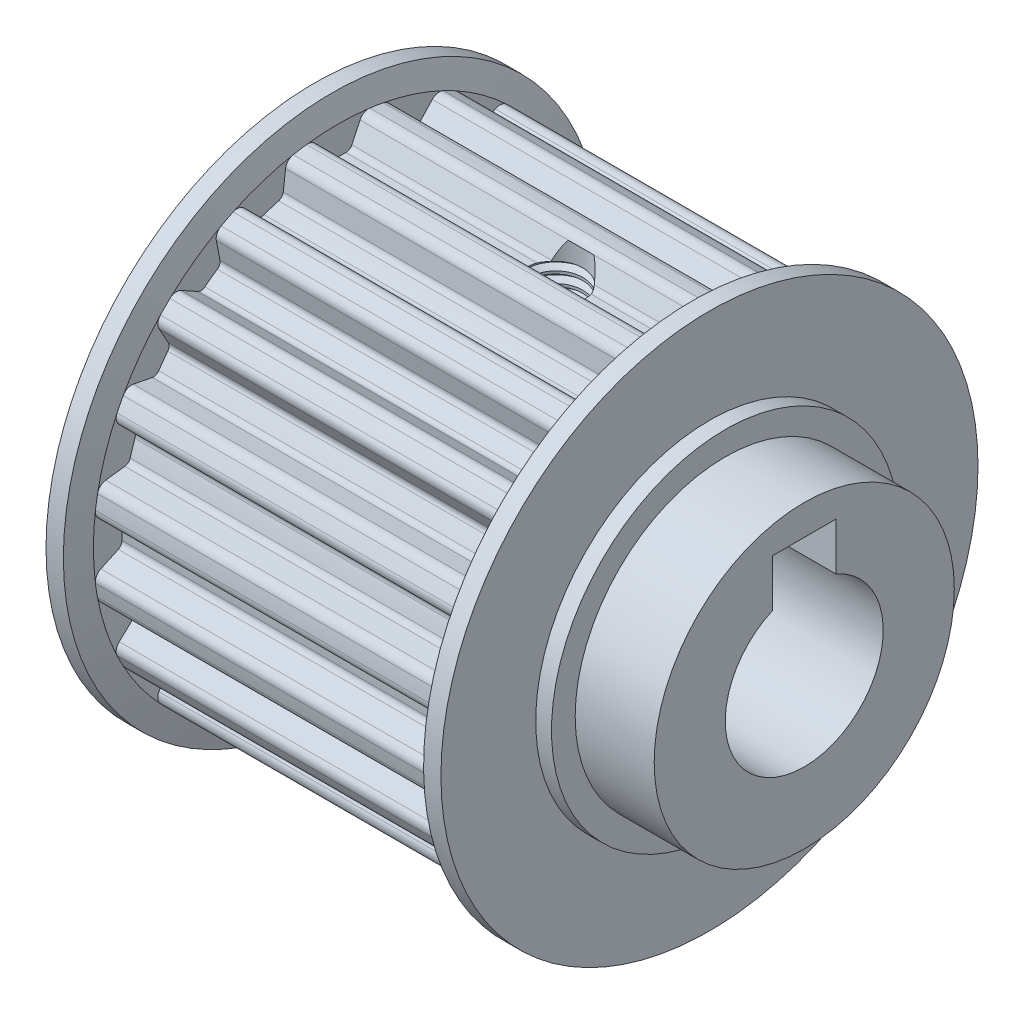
SolidWorks part; units mm, degrees
ref_plane "Front" through (0, 0, 0) normal (0, 0, 1) x (1, 0, 0)
ref_plane "Top" through (0, 0, 0) normal (0, 1, 0) x (1, 0, 0)
ref_plane "Right" through (0, 0, 0) normal (1, 0, 0) x (0, 0, -1)
imported_body "Hammashihnapyörä 20T5_20D10K4"
sketch "Sketch1" plane through (39, 0, 0) normal (1, 0, 0) x (0, 0, -1)
  line L0 (-1.5, 3.7081) -> (-1.5, 5.4)
  line L1 (-1.5, 5.4) -> (1.5, 5.4)
  line L2 (1.5, 5.4) -> (1.5, 3.7081)
  line L3 (3.994, 0.2194) -> (9.4857, 0.5211)
  line L4 (-3.0915, -2.5382) -> (2.3763, -9.198)
  circle A0 centre (0, 0) radius 9.5
  arc A1 (-1.5, 3.7081) -> (1.5, 3.7081) centre (0, 0) ccw
extrude "Boss-Extrude1" add sketch "Sketch1" against normal blind 10 contours L4 L3 M9 M6
sketch "Sketch2" plane through (39, 0, 0) normal (1, 0, 0) x (0, 0, -1)
  circle A0 centre (0, 0) radius 9.5
extrude "Cut-Extrude1" cut sketch "Sketch2" against normal blind 7
sketch "Sketch3" plane through (32, 0, 0) normal (1, 0, 0) x (0, 0, -1)
  circle A1 centre (0, 0) radius 9.5
  circle A3 centre (0, 0) radius 5
extrude "Boss-Extrude2" add sketch "Sketch3" against normal up to surface (32 mm away)
ref_plane "Plane1" through (0, 15.0289, 0) normal (0, -1, 0) x (-1, 0, 0)
sketch "Sketch4" plane through (0, 15.0289, 0) normal (0, -1, 0) x (-1, 0, 0)
  line L0 (-24.5, -1.3793) -> (-24.5, -0.8631) construction
  circle A0 centre (-16.5, 0) radius 1.6
  dimension "D1" = 8
extrude "Cut-Extrude2" cut sketch "Sketch4" along normal up to surface (11.3629 mm away)
thread "Thread1" pitch 0.7 start angle 0, offset 0, length 12, pitch 0.7, diameter 3.2
ref_plane "Plane2" through (14.9, 13.9221, 0) normal (0, 0, 1) x (-1, 0, 0)
sketch "Thread Profile1" plane through (14.9, 13.9221, 0) normal (0, 0, 1) x (-1, 0, 0)
  line L0 (0, 0) -> (0, 0.7) construction
  line L1 (0, 0) -> (0.3789, 0.2187)
  line L2 (0.3789, 0.2187) -> (0.3789, 0.3062)
  line L3 (0.3789, 0.3062) -> (0, 0.525)
  line L4 (0.3789, 0.2625) -> (0, 0.2625) construction
  line L11 (0, 0) -> (0, 0.525)
  point P2 (0, 0)
  dimension "Pitch" = 0.7
  dimension "Profile_Angle" = 60
  dimension "Profile_Land" = 0.0875
  dimension "Profile_Height" = 0.3789
ref_plane "Plane3" through (13.5, 0, 0) normal (1, 0, 0) x (0, 0, -1)
sketch "Sketch7" plane through (13.5, 0, 0) normal (1, 0, 0) x (0, 0, -1)
  circle A0 centre (0, 0) radius 17.4
ref_plane "Plane4" through (0, 0, 0) normal (0, 0, 1) x (1, 0, 0)
sketch "Sketch8" plane through (0, 0, 0) normal (0, 0, 1) x (1, 0, 0)
  line L0 (-0.3027, 17) -> (27.3027, 17)
  line L2 (-0.3027, 17) -> (-0.3027, 18.3969)
  line L3 (-0.3027, 18.3969) -> (27.3027, 18.1783)
  line L4 (27.3027, 18.1783) -> (27.3027, 17)
  line L5 (-1000, 0) -> (49000, 0) construction
  point P3 (13.5, 17)
  dimension "D1" = 17
revolve "Cut-Revolve1" cut sketch "Sketch8" angle 360 about L5
sketch "Sketch9" plane through (0, 0, 0) normal (-1, 0, 0) x (0, 0, 1)
  circle A0 centre (0, 0) radius 8 construction
  text T0 "20T5-20D10K4" font "Century Gothic" height 2.5
extrude "Cut-Extrude3" cut sketch "Sketch9" against normal blind 0.25
sketch "Sketch10" plane through (0.9, 0, 0) normal (-1, 0, 0) x (0, 0, 1)
  circle A0 centre (0, 0) radius 12
  circle A1 centre (0, 0) radius 18.0003
extrude "Cut-Extrude4" cut sketch "Sketch10" along normal blind 2
sketch "Sketch11" plane through (26.1, 0, 0) normal (1, 0, 0) x (0, 0, -1)
  circle A0 centre (0, 0) radius 12
  circle A1 centre (0, 0) radius 17.6848
extrude "Cut-Extrude5" cut sketch "Sketch11" along normal blind 2
sketch "Sketch12" plane through (32, 0, 0) normal (1, 0, 0) x (0, 0, -1)
  line L1 (2, 7.5826) -> (-2, 7.5826)
  line L2 (2, 7.5826) -> (2, 4.5826)
  line L4 (-2, 7.5826) -> (-2, 4.5826)
  arc A1 (-2, 4.5826) -> (2, 4.5826) centre (0, 0) ccw
  dimension "D1" = 4
  dimension "D2" = 5
  dimension "D3" = 3
extrude "Cut-Extrude6" cut sketch "Sketch12" against normal up to surface (32 mm away)
sketch "Sketch13" plane through (0.9, 0, 0) normal (-1, 0, 0) x (0, 0, 1)
  circle A0 centre (0, 0) radius 12
  circle A1 centre (0, 0) radius 17
extrude "Cut-Extrude7" cut sketch "Sketch13" against normal blind 0.1
sketch "Sketch14" plane through (26.1, 0, 0) normal (1, 0, 0) x (0, 0, -1)
  circle A0 centre (0, 0) radius 12
  circle A1 centre (0, 0) radius 17
extrude "Cut-Extrude8" cut sketch "Sketch14" against normal blind 0.1
sketch "Sketch15" plane through (27, 0, 0) normal (1, 0, 0) x (0, 0, -1)
  circle A0 centre (0, 0) radius 11
  circle A1 centre (0, 0) radius 12
extrude "Cut-Extrude9" cut sketch "Sketch15" against normal up to surface (1 mm away) contours A0 M1
sketch "Sketch16" plane through (0, 0, 0) normal (-1, 0, 0) x (0, 0, 1)
  circle A0 centre (0, 0) radius 11
  circle A1 centre (0, 0) radius 12
extrude "Cut-Extrude10" cut sketch "Sketch16" against normal up to surface (1 mm away) contours A1 A0
